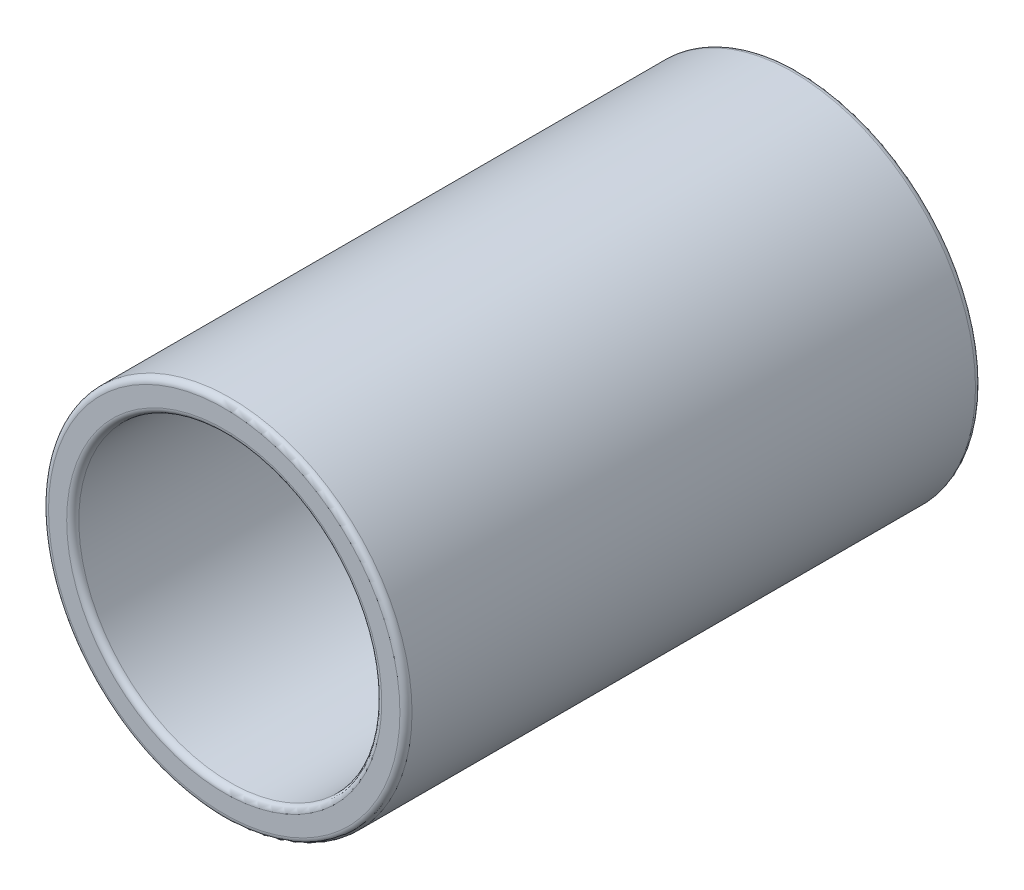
SolidWorks part; units mm, degrees
ref_plane "Plan1" through (0, 0, 0) normal (0, 0, 1) x (1, 0, 0)
ref_plane "Plan2" through (0, 0, 0) normal (0, 1, 0) x (1, 0, 0)
ref_plane "Plan3" through (0, 0, 0) normal (1, 0, 0) x (0, 0, -1)
sketch "Esquisse1" plane through (0, 0, 0) normal (0, 0, 1) x (1, 0, 0)
  circle A0 centre (0, 0) radius 3
  circle A1 centre (0, 0) radius 2.5
  dimension "D1" = 5
  dimension "D2" = 6
extrude "Extrusion1" add sketch "Esquisse1" along normal blind 9.5
fillet "Congé1" radius 0.1
